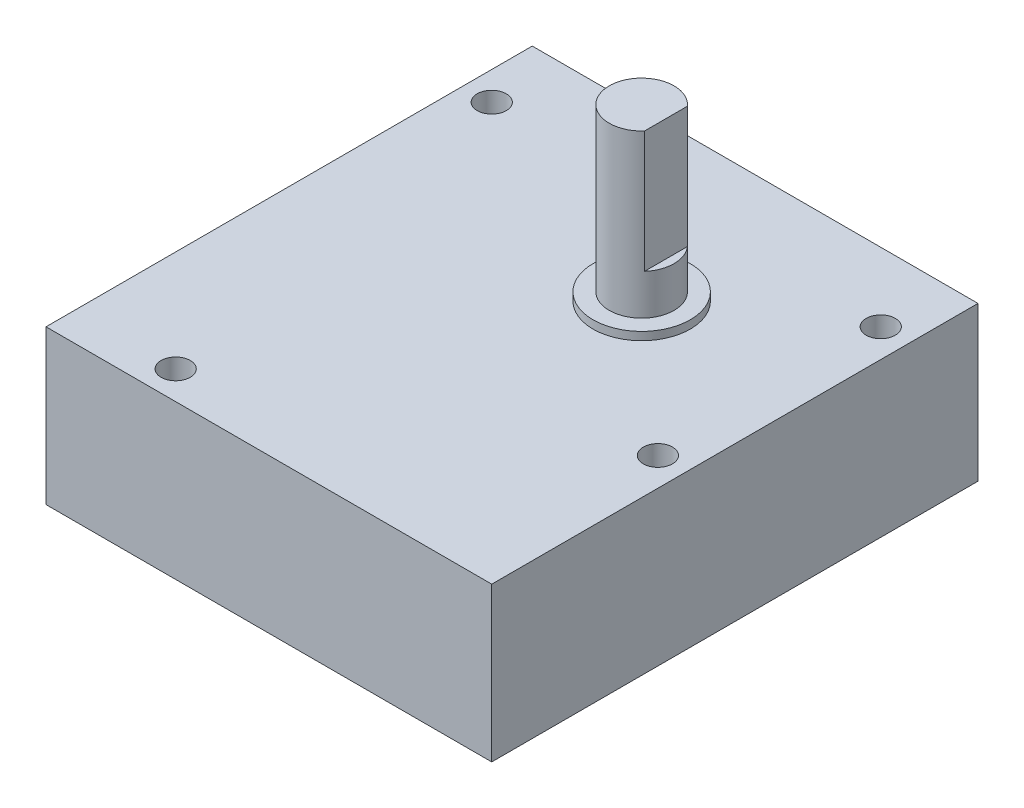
SolidWorks part; units mm, degrees
ref_plane "Front Plane" through (0, 0, 0) normal (0, 0, 1) x (1, 0, 0)
ref_plane "Top Plane" through (0, 0, 0) normal (0, 1, 0) x (1, 0, 0)
ref_plane "Right Plane" through (0, 0, 0) normal (1, 0, 0) x (0, 0, -1)
sketch "Sketch2" plane through (0, 0, 0) normal (0, 1, 0) x (1, 0, 0)
  line L1 (-27.5, 30) -> (27.5, 30)
  line L2 (-27.5, 30) -> (-27.5, -30)
  line L3 (-27.5, -30) -> (27.5, -30)
  line L4 (27.5, 30) -> (27.5, -30)
  line L5 (-27.5, 30) -> (27.5, -30) construction
  line L6 (-27.5, -30) -> (27.5, 30) construction
  point P0 (0, 0)
  dimension "D1" = 60
  dimension "D2" = 55
extrude "Boss-Extrude1" add sketch "Sketch2" along normal blind 19
sketch "Sketch3" plane through (0, 19, 0) normal (0, 1, 0) x (1, 0, 0)
  line L0 (-27.5, 30) -> (-27.5, -30) construction
  line L1 (27.5, 30) -> (-27.5, 30) construction
  line L2 (0, 0) -> (0, 30) construction
  line L3 (-27.5, -30) -> (27.5, -30) construction
  circle A0 centre (-15, -26.5) radius 1.8
  circle A1 centre (-24, 21.5) radius 1.8
  circle A2 centre (24, 21.5) radius 1.8
  circle A3 centre (24, -6) radius 1.8
  dimension "D1" = 3.6
  dimension "D2" = 3.5
  dimension "D3" = 8.5
  dimension "D4" = 27.5
  dimension "D5" = 12.5
  dimension "D6" = 3.5
extrude "Cut-Extrude1" cut sketch "Sketch3" against normal through all and the other way through all
sketch "Sketch4" plane through (0, 19, 0) normal (0, 1, 0) x (1, 0, 0)
  line L0 (27.5, 30) -> (-27.5, 30) construction
  line L1 (27.5, -30) -> (27.5, 30) construction
  circle A0 centre (6.5, 9.5) radius 4
  point P6 (9.2986, 3.2944)
  point P7 (6.793, 13.4893)
  dimension "D2" = 8
  dimension "D3" = 21
  dimension "D1" = 20.5
extrude "Boss-Extrude2" add sketch "Sketch4" along normal blind 21
sketch "Sketch5" plane through (0, 40, 0) normal (0, 1, 0) x (1, 0, 0)
  line L0 (9.5, 12.1458) -> (9.5, 6.8542)
  arc A0 (9.5, 6.8542) -> (9.5, 12.1458) centre (6.5, 9.5) ccw
  circle A1 centre (6.5, 9.5) radius 4 construction
  point P5 (8.8735, 6.2803)
  dimension "D1" = 7
extrude "Cut-Extrude2" cut sketch "Sketch5" against normal blind 15
sketch "Sketch6" plane through (0, 19, 0) normal (0, 1, 0) x (1, 0, 0)
  circle A0 centre (6.5, 9.5) radius 6
  dimension "D1" = 12
extrude "Boss-Extrude3" add sketch "Sketch6" along normal blind 1
